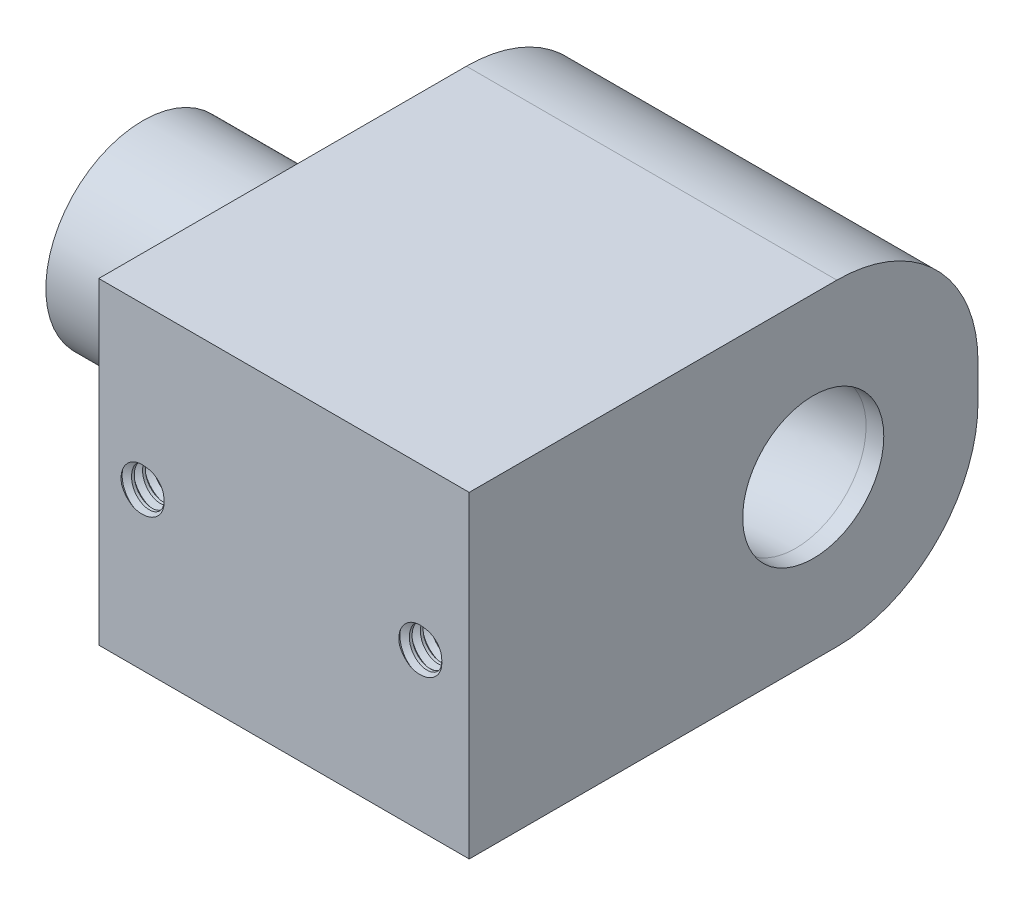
SolidWorks part; units mm, degrees
ref_plane "Front Plane" through (0, 0, 0) normal (0, 0, 1) x (1, 0, 0)
ref_plane "Top Plane" through (0, 0, 0) normal (0, 1, 0) x (1, 0, 0)
ref_plane "Right Plane" through (0, 0, 0) normal (1, 0, 0) x (0, 0, -1)
sketch "Sketch1" plane through (0, 0, 0) normal (0, 0, 1) x (1, 0, 0)
  line L1 (-13.335, 11.43) -> (13.335, 11.43)
  line L2 (-13.335, 11.43) -> (-13.335, -11.43)
  line L3 (-13.335, -11.43) -> (13.335, -11.43)
  line L4 (13.335, 11.43) -> (13.335, -11.43)
  line L5 (-13.335, 11.43) -> (13.335, -11.43) construction
  line L6 (-13.335, -11.43) -> (13.335, 11.43) construction
  point P0 (0, 0)
  dimension "D1" = 22.86
  dimension "D2" = 26.67
extrude "Boss-Extrude1" add sketch "Sketch1" along normal blind 36.6268
sketch "Sketch2" plane through (0, 0, 36.6268) normal (0, 0, 1) x (1, 0, 0)
  line L0 (-10, 0) -> (10, 0) construction
  circle A0 centre (-10, 0) radius 1.3589
  circle A1 centre (10, 0) radius 1.3589
  point P4 (0, 0)
  dimension "D1" = 2.7178
  dimension "D2" = 20
extrude "Cut-Extrude1" cut sketch "Sketch2" against normal blind 12.7
sketch "Sketch3" plane through (13.335, 0, 0) normal (1, 0, 0) x (0, 0, -1)
  line L0 (-36.6268, -11.43) -> (-36.6268, 11.43) construction
  circle A0 centre (-11.8618, 0) radius 5.08
  dimension "D1" = 10.16
  dimension "D2" = 24.765
extrude "Cut-Extrude2" cut sketch "Sketch3" against normal blind 1.27
sketch "Sketch4" plane through (-13.335, 0, 0) normal (-1, 0, 0) x (0, 0, 1)
  circle A0 centre (20.7518, 0) radius 6.985
  circle A1 centre (20.7518, 0) radius 5.08
  circle A2 centre (11.8618, 0) radius 5.08 construction
  dimension "D1" = 13.97
  dimension "D2" = 10.16
  dimension "D3" = 8.89
extrude "Boss-Extrude2" add sketch "Sketch4" along normal blind 12.7
fillet "Fillet1" radius 2.54 1 edges at (-13.335, 6.985, 20.7518)
sketch "Sketch5" plane through (-13.335, 0, 0) normal (-1, 0, 0) x (0, 0, 1)
  circle A1 centre (20.7518, 0) radius 5.08
  circle A2 centre (20.7518, 0) radius 5.08
  dimension "D1" = 0
sketch "Sketch6" plane through (0, 0, 0) normal (0, 1, 0) x (1, 0, 0)
  line L0 (-13.335, -20.7518) -> (-21.0978, -20.7518) construction
  line L1 (-13.335, -15.6718) -> (-13.335, -25.8318) construction
  line L2 (12.065, -11.8618) -> (17.0171, -11.8618) construction
  line L3 (12.065, -16.9418) -> (12.065, -6.7818) construction
  arc A0 (-13.335, -20.7518) -> (-0.635, -16.3068) centre (-13.335, -0.3864) ccw
  arc A1 (12.065, -11.8618) -> (-0.635, -16.3068) centre (12.065, -32.2272) ccw
sweep "Cut-Sweep1" cut profiles "Sketch5" path "Sketch6"
sketch "Sketch7" plane through (13.335, 0, 0) normal (1, 0, 0) x (0, 0, -1)
  circle A3 centre (-11.8618, 0) radius 9.525
  circle A4 centre (-11.8618, 0) radius 10.795
  dimension "D1" = 19.05
  dimension "D2" = 21.59
extrude "Boss-Extrude3" [suppressed] add sketch "Sketch7" along normal blind 2.54
thread "Thread1" pitch 0.7937 start angle 0, offset 1, length 12.7, pitch 0.7937, diameter 2.7178
ref_plane "Plane1" through (8.6411, 0, 37.6268) normal (0, -1, 0) x (-1, 0, 0)
sketch "Thread Profile1" plane through (8.6411, 0, 37.6268) normal (0, -1, 0) x (-1, 0, 0)
  line L0 (0, 0) -> (0, 0.7937) construction
  line L1 (0, 0) -> (0.4296, 0.248)
  line L2 (0.4296, 0.248) -> (0.4296, 0.3473)
  line L3 (0.4296, 0.3473) -> (0, 0.5953)
  line L4 (0.4296, 0.2977) -> (0, 0.2977) construction
  line L11 (0, 0) -> (0, 0.5953)
  point P2 (0, 0)
  dimension "Pitch" = 0.7937
  dimension "Profile_Angle" = 60
  dimension "Profile_Land" = 0.0992
  dimension "Profile_Height" = 0.4296
thread "Thread2" pitch 0.7937 start angle 0, offset 1, length 12.7, pitch 0.7937, diameter 2.7178
ref_plane "Plane2" through (-11.3589, 0, 37.6268) normal (0, -1, 0) x (-1, 0, 0)
sketch "Thread Profile2" plane through (-11.3589, 0, 37.6268) normal (0, -1, 0) x (-1, 0, 0)
  line L0 (0, 0) -> (0, 0.7937) construction
  line L1 (0, 0) -> (0.4296, 0.248)
  line L2 (0.4296, 0.248) -> (0.4296, 0.3473)
  line L3 (0.4296, 0.3473) -> (0, 0.5953)
  line L4 (0.4296, 0.2977) -> (0, 0.2977) construction
  line L11 (0, 0) -> (0, 0.5953)
  point P2 (0, 0)
  dimension "Pitch" = 0.7937
  dimension "Profile_Angle" = 60
  dimension "Profile_Land" = 0.0992
  dimension "Profile_Height" = 0.4296
fillet "Fillet2" radius 10.16 2 edges at (0, -11.43, 0) (0, 11.43, 0)
